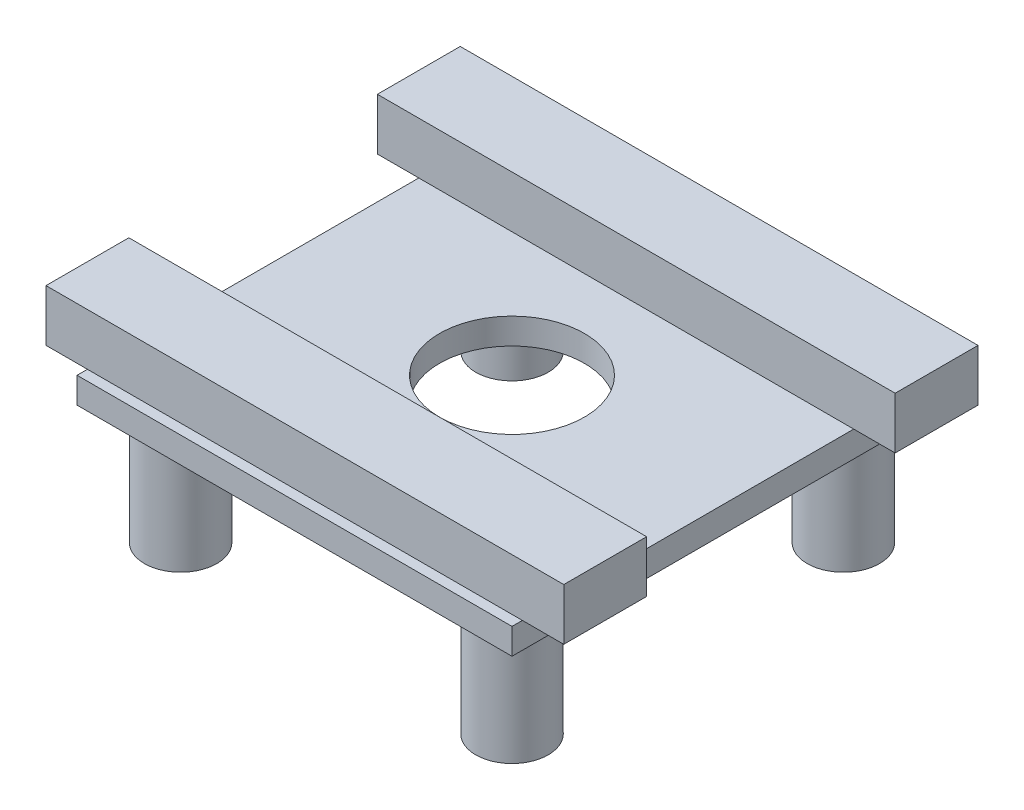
SolidWorks part; units mm, degrees
ref_plane "Front Plane" through (0, 0, 0) normal (0, 0, 1) x (1, 0, 0)
ref_plane "Top Plane" through (0, 0, 0) normal (0, 1, 0) x (1, 0, 0)
ref_plane "Right Plane" through (0, 0, 0) normal (1, 0, 0) x (0, 0, -1)
sketch "Sketch1" plane through (0, 0, 0) normal (0, 1, 0) x (1, 0, 0)
  line L1 (-50000, -40000) -> (50000, -40000)
  line L2 (-50000, -40000) -> (-50000, -24000)
  line L3 (-50000, -24000) -> (50000, -24000)
  line L4 (50000, -40000) -> (50000, -24000)
extrude "Boss-Extrude1" add sketch "Sketch1" along normal blind 10000
sketch "Sketch2" plane through (0, 0, 0) normal (0, 1, 0) x (1, 0, 0)
  line L1 (-50000, 24000) -> (50000, 24000)
  line L2 (-50000, 24000) -> (-50000, 40000)
  line L3 (-50000, 40000) -> (50000, 40000)
  line L4 (50000, 24000) -> (50000, 40000)
extrude "Boss-Extrude2" add sketch "Sketch2" along normal blind 10000
sketch "Sketch3" plane through (0, 0, 0) normal (0, 1, 0) x (1, 0, 0)
  circle A0 centre (-32000, -32000) radius 7000
  circle A1 centre (32000, -32000) radius 7000
  circle A2 centre (-32000, 32000) radius 7000
  circle A3 centre (32000, 32000) radius 7000
extrude "Boss-Extrude3" add sketch "Sketch3" against normal blind 28000
sketch "Sketch4" plane through (0, 0, 0) normal (0, 1, 0) x (1, 0, 0)
  line L1 (-42000, -42000) -> (42000, -42000)
  line L2 (-42000, -42000) -> (-42000, 42000)
  line L3 (-42000, 42000) -> (42000, 42000)
  line L4 (42000, -42000) -> (42000, 42000)
  circle A0 centre (0, 0) radius 14000
extrude "Boss-Extrude4" add sketch "Sketch4" against normal blind 5000
